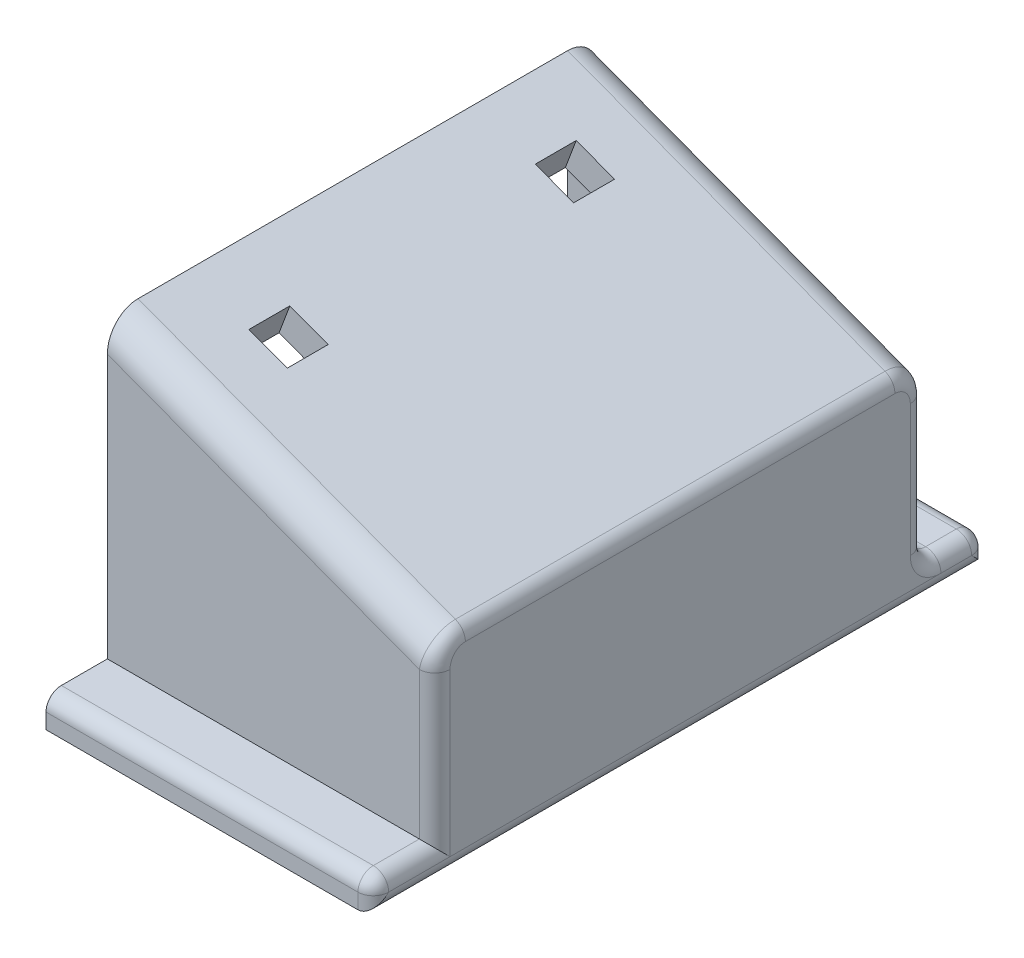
SolidWorks part; units mm, degrees
ref_plane "Front Plane" through (0, 0, 0) normal (0, 0, 1) x (1, 0, 0)
ref_plane "Top Plane" through (0, 0, 0) normal (0, 1, 0) x (1, 0, 0)
ref_plane "Right Plane" through (0, 0, 0) normal (1, 0, 0) x (0, 0, -1)
sketch "Sketch5" plane through (0, 0, 0) normal (0, 0, 1) x (1, 0, 0)
  line L0 (0, 0) -> (32, 0)
  line L1 (32, 0) -> (32, 20)
  line L2 (0, 32) -> (0, 0)
  line L3 (32, 20) -> (0, 32)
  dimension "D2" = 32
  dimension "D1" = 32
  dimension "D3" = 20
extrude "Boss-Extrude6" add sketch "Sketch5" along normal mid plane 48
shell "Shell1" thickness 3
sketch "Sketch6" plane through (0, 0, 0) normal (0, -1, 0) x (1, 0, 0)
  line L0 (32, 24) -> (32, -24) construction
  line L1 (0, 24) -> (32, 24)
  line L2 (0, 24) -> (0, 30)
  line L3 (0, 30) -> (32, 30)
  line L4 (32, 24) -> (32, 30)
  dimension "D1" = 6
extrude "Boss-Extrude7" add sketch "Sketch6" against normal blind 3
mirror "Mirror1" about plane through (0, 0, 0) normal (0, 0, 1) of "Boss-Extrude7"
sketch "Sketch7" plane through (10.5205, 28.0548, 0) normal (0.3511, 0.9363, 0) x (0.9363, -0.3511, 0)
  line L0 (0, 0) -> (-23.1779, 0) construction
  line L1 (-5, 12) -> (-1, 12)
  line L2 (-5, 12) -> (-5, 16)
  line L3 (-5, 16) -> (-1, 16)
  line L4 (-1, 12) -> (-1, 16)
  line L5 (-5, 12) -> (-1, 16) construction
  line L6 (-5, 16) -> (-1, 12) construction
  line L7 (-5, -16) -> (-1, -12) construction
  line L8 (-5, -12) -> (-1, -16) construction
  line L9 (-1, -12) -> (-1, -16)
  line L10 (-5, -16) -> (-1, -16)
  line L11 (-5, -12) -> (-5, -16)
  line L12 (-5, -12) -> (-1, -12)
  point P0 (-3, 14)
  point P12 (-3, -14)
  point P13 (-2.2498, 13.818)
  dimension "D1" = 4
  dimension "D2" = 4
  dimension "D3" = 14
  dimension "D4" = 3
extrude "Cut-Extrude1" cut sketch "Sketch7" against normal through all
fillet "Fillet1" radius 3 4 edges at (14.5, 23.3585, 21) (14.5, 23.3585, -21) (16, 26, -24) (16, 26, 24)
fillet "Fillet2" radius 1.5 4 edges at (14.5, 0, 21) (16, 3, -30) (16, 3, -24) (16, 3, 30)
fillet "Fillet3" radius 1.5 13 edges at (32, 19.0616, 23.1213) (32, 20, 0) (32, 19.0616, -23.1213) (32, 10.648, -24) (32, 0, 0) (32, 9.898, 24) (32, 3, -27) (32, 0.75, -30) (32, 0.75, 30) (32, 3, 26.25) (32, 2.5607, 29.5607) (32, 3.4393, -24.4393) (32, 2.5607, -29.5607)
